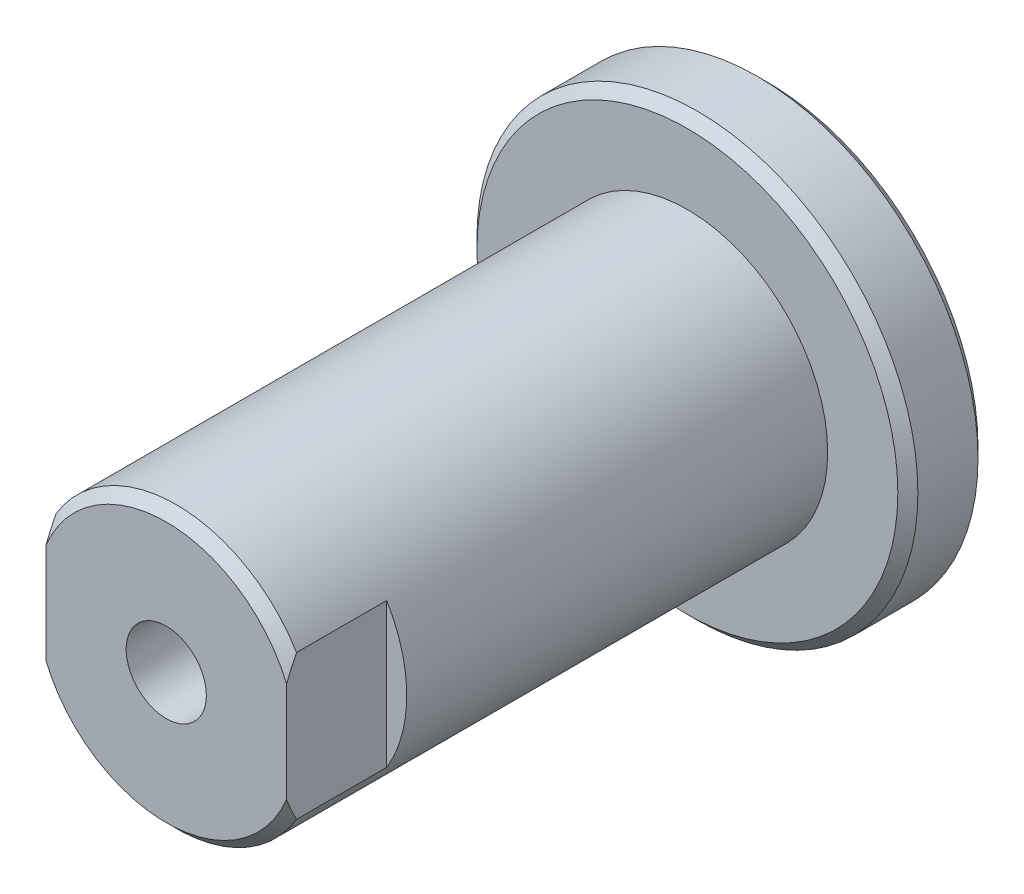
SolidWorks part; units mm, degrees
ref_plane "Face" through (0, 0, 0) normal (0, 0, 1) x (1, 0, 0)
ref_plane "Dessus" through (0, 0, 0) normal (0, 1, 0) x (1, 0, 0)
ref_plane "Droite" through (0, 0, 0) normal (1, 0, 0) x (0, 0, -1)
sketch "Esquisse1" plane through (0, 0, 0) normal (0, 0, 1) x (1, 0, 0)
  circle A0 centre (0, 0) radius 11
  dimension "D1" = 22
extrude "Extrusion1" add sketch "Esquisse1" along normal blind 4
sketch "Esquisse2" plane through (0, 0, 4) normal (0, 0, 1) x (1, 0, 0)
  circle A0 centre (0, 0) radius 7
  dimension "D1" = 14
extrude "Extrusion2" add sketch "Esquisse2" along normal blind 26
chamfer "Chanfrein2" distance 0.5 angle 45 3 edges at (7, 0, 30) (11, 0, 0) (11, 0, 4)
sketch "Esquisse3" plane through (0, 0, 30) normal (0, 0, 1) x (1, 0, 0)
  line L1 (6, 11.2334) -> (14.7084, 11.2334)
  line L2 (6, 11.2334) -> (6, -10.615)
  line L3 (6, -10.615) -> (14.7084, -10.615)
  line L4 (14.7084, 11.2334) -> (14.7084, -10.615)
  line L5 (-6, 13.8098) -> (-13.4717, 13.8098)
  line L6 (-6, 13.8098) -> (-6, -10.615)
  line L7 (-6, -10.615) -> (-13.4717, -10.615)
  line L8 (-13.4717, 13.8098) -> (-13.4717, -10.615)
  dimension "D1" = 12
  dimension "D2" = 6
extrude "Enlèv. mat.-Extru.1" cut sketch "Esquisse3" against normal blind 5
hole_wizard "Diamètre du perçage Ø4.0 (4.000000)1" positions "Esquisse5" profile "Esquisse4" hole size "Ø4.0" standard "ISO"
sketch "Esquisse5" plane through (0, 0, 30) normal (0, 0, 1) x (1, 0, 0)
  arc A0 (6, 2.5) -> (-6, 2.5) centre (0, 0) ccw construction
  point P0 (0, 0)
sketch "Esquisse4" plane through (0, 0, 30) normal (1, 0, 0) x (0, -1, 0)
  line L0 (0, 0) -> (0, 30)
  line L1 (0, 30) -> (2, 30)
  line L2 (2, 30) -> (2, 0)
  line L5 (2, 0) -> (0, 0)
  line L11 (0, -6.35) -> (0, 107.95) construction
  dimension "Diamètre du perçage jusqu'au prochain" = 4
  dimension "Profondeur du perçage jusqu'au prochain" = 30
